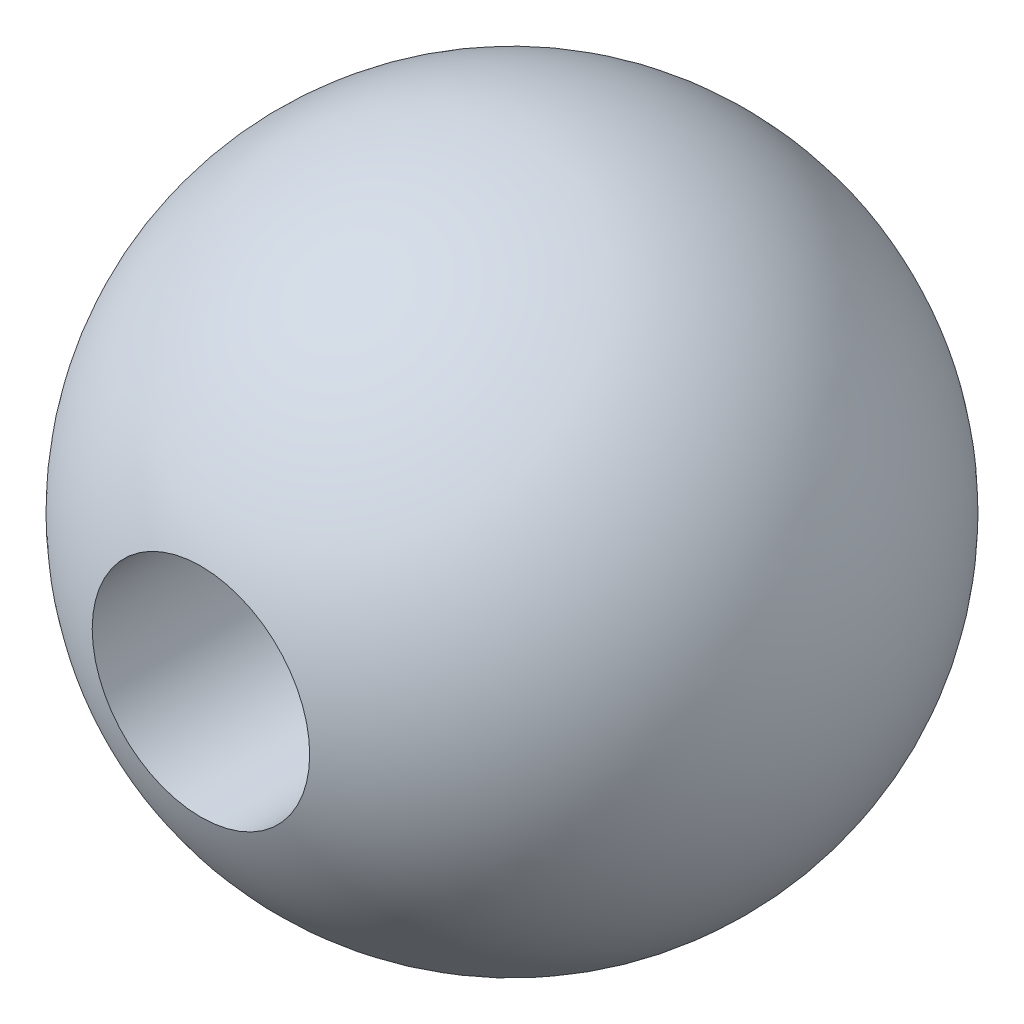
SolidWorks part; units mm, degrees
ref_plane "Płaszczyzna przednia" through (0, 0, 0) normal (0, 0, 1) x (1, 0, 0)
ref_plane "Płaszczyzna górna" through (0, 0, 0) normal (0, 1, 0) x (1, 0, 0)
ref_plane "Płaszczyzna prawa" through (0, 0, 0) normal (1, 0, 0) x (0, 0, -1)
sketch "Szkic1" plane through (0, 0, 0) normal (0, 0, 1) x (1, 0, 0)
  line L0 (-5, 0) -> (5, 0)
  arc A0 (5, 0) -> (-5, 0) centre (0, 0) ccw
  dimension "D1" = 5
revolve "Obrót1" add sketch "Szkic1" angle 360 about L0
ref_plane "Płaszczyzna1" through (0, 0, 5) normal (0, 0, 1) x (1, 0, 0)
sketch "Szkic2" plane through (0, 0, 5) normal (0, 0, 1) x (1, 0, 0)
  point P0 (0, 0)
hole_wizard "Otwór gwintowany M41" positions "Szkic3" profile "Szkic4" tap size "M4" standard "DIN"
sketch "Szkic3" plane through (0, 0, 5) normal (0, 0, 1) x (1, 0, 0)
  point P0 (0, 0)
sketch "Szkic4" plane through (0, 0, 5) normal (1, 0, 0) x (0, -1, 0)
  line L0 (0, 0) -> (0, 8)
  line L1 (0, 8) -> (1.65, 7.0086)
  line L2 (1.65, 7.0086) -> (1.65, 0)
  line L5 (1.65, 0) -> (0, 0)
  line L10 (0, 8) -> (-1.65, 7.0086) construction
  line L11 (0, -6.35) -> (0, 107.95) construction
  dimension "Średnica wiertła gwintu" = 3.3
  dimension "Głębokość otworu gwintowanego" = 8
  dimension "Kąt wiertła" = 118
